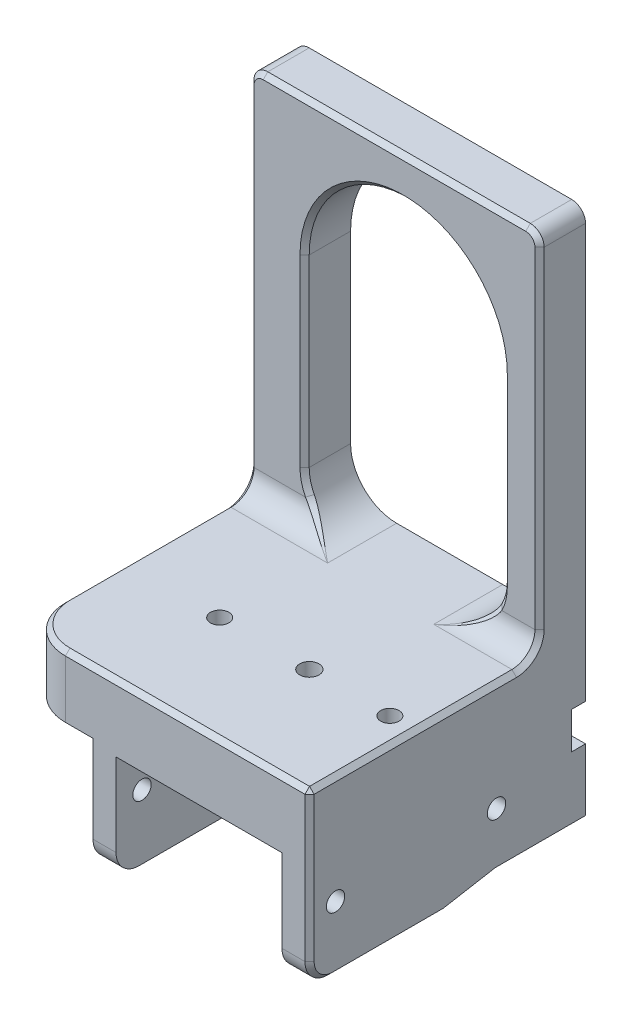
SolidWorks part; units mm, degrees
ref_plane "Aufriss" through (0, 0, 0) normal (0, 0, 1) x (1, 0, 0)
ref_plane "Grundriss" through (0, 0, 0) normal (0, 1, 0) x (1, 0, 0)
ref_plane "Seitenriss" through (0, 0, 0) normal (1, 0, 0) x (0, 0, -1)
sketch "Skizze1" plane through (0, 0, 0) normal (0, 1, 0) x (1, 0, 0)
  line L1 (-15, -30) -> (15, -30)
  line L2 (-15, -30) -> (-15, 30)
  line L3 (-15, 30) -> (15, 30)
  line L4 (15, -30) -> (15, 30)
  line L5 (-15, -30) -> (15, 30) construction
  line L6 (-15, 30) -> (15, -30) construction
  point P0 (0, 0)
  dimension "D1" = 30
  dimension "D2" = 60
extrude "Aufsatz-Linear austragen1" add sketch "Skizze1" along normal mid plane 14.5
hole_wizard "Ø4.0 (4) Durchmesser Bohrung1" positions "Skizze8" profile "Skizze9" hole size "Ø4.0" standard "DIN"
sketch "Skizze8" plane through (0, 7.25, 0) normal (0, 1, 0) x (1, 0, 0)
  line L3 (-15, -30) -> (15, -30) construction
  line L4 (15, -30) -> (15, 30) construction
  point P0 (0.55, -7)
  dimension "D1" = 23
  dimension "D2" = 14.45
sketch "Skizze9" plane through (0.55, 7.25, 7) normal (1, 0, 0) x (0, 0, 1)
  line L0 (0, 0) -> (0, 14.5)
  line L1 (0, 14.5) -> (2.1, 14.5)
  line L2 (2.1, 14.5) -> (2.1, 0)
  line L5 (2.1, 0) -> (0, 0)
  line L11 (0, -6.35) -> (0, 107.95) construction
  dimension "Bohrerdurchmesser" = 4.2
  dimension "Bohrungstiefe" = 14.5
sketch "Skizze10" plane through (0, -7.25, 0) normal (0, -1, 0) x (1, 0, 0)
  line L0 (-15, 6) -> (-7.3873, 6)
  line L1 (-15, -30) -> (-15, 30) construction
  line L2 (15, 30) -> (15, -30) construction
  line L3 (15, 6) -> (15, -30)
  line L4 (15, -30) -> (-15, -30)
  line L5 (-15, -30) -> (-15, 6)
  line L6 (8.4873, 6) -> (15, 6)
  line L7 (15, -30) -> (-15, -30) construction
  arc A0 (-7.3873, 6) -> (8.4873, 6) centre (0.55, 7) ccw
  dimension "D1" = 16
  dimension "D2" = 1
extrude "Aufsatz-Linear austragen2" add sketch "Skizze10" along normal blind 19
sketch "Skizze14" plane through (0, 0, 6) normal (0, 0, 1) x (1, 0, 0)
  line L0 (-15, 7.25) -> (15, 7.25) construction
  line L1 (-15, -26.25) -> (-17.3873, -26.25)
  line L2 (-15, -26.25) -> (-15, 7.25)
  line L3 (-15, 7.25) -> (-17.3873, 7.25)
  line L4 (-17.3873, -26.25) -> (-17.3873, 7.25)
  line L5 (15, -26.25) -> (18.4873, -26.25)
  line L6 (15, -26.25) -> (15, 7.25)
  line L7 (15, 7.25) -> (18.4873, 7.25)
  line L8 (18.4873, -26.25) -> (18.4873, 7.25)
  line L9 (-7.3873, -26.25) -> (-7.3873, -7.25) construction
  line L10 (8.4873, -26.25) -> (8.4873, -7.25) construction
  dimension "D1" = 10
  dimension "D2" = 10
extrude "Aufsatz-Linear austragen3" add sketch "Skizze14" against normal up to surface (36 mm away)
hole_wizard "Ø4.0 (4) Durchmesser Bohrung2" positions "Skizze15" profile "Skizze16" hole size "Ø4.0" standard "DIN"
sketch "Skizze15" plane through (0, 0, 6) normal (0, 0, 1) x (1, 0, 0)
  line L0 (-7.3873, -16.75) -> (-12.3873, -16.75) construction
  line L1 (-7.3873, -26.25) -> (-7.3873, -7.25) construction
  line L3 (-17.3873, 7.25) -> (-17.3873, -26.25) construction
  line L4 (18.4873, -26.25) -> (18.4873, 7.25) construction
  point P0 (-12.3873, -16.75)
  point P2 (13.4873, -16.75)
  dimension "D1" = 5
  dimension "D2" = 5
sketch "Skizze16" plane through (-12.3873, -16.75, 6) normal (1, 0, 0) x (0, -1, 0)
  line L0 (0, 0) -> (0, 6)
  line L1 (0, 6) -> (2, 6)
  line L2 (2, 6) -> (2, 0)
  line L5 (2, 0) -> (0, 0)
  line L10 (0, 6) -> (-2, 6) construction
  line L11 (0, -6.35) -> (0, 107.95) construction
  dimension "Bohrerdurchmesser" = 4
  dimension "Bohrungstiefe" = 6
  dimension "Spitzenwinkel" = 180
sketch "Skizze17" plane through (0, -26.25, 0) normal (0, -1, 0) x (1, 0, 0)
  line L0 (18.4873, -30) -> (18.4873, 6) construction
  line L1 (-17.3873, -30) -> (18.4873, -30)
  line L2 (-17.3873, -30) -> (-17.3873, -10.5)
  line L3 (-17.3873, -10.5) -> (18.4873, -10.5)
  line L4 (18.4873, -30) -> (18.4873, -10.5)
  dimension "D1" = 19.5
extrude "Aufsatz-Linear austragen4" add sketch "Skizze17" along normal blind 2
hole_wizard "Ø4.0 (4) Durchmesser Bohrung3" positions "Skizze18" profile "Skizze19" hole size "Ø4.0" standard "DIN"
sketch "Skizze18" plane through (0, -28.25, 0) normal (0, -1, 0) x (-1, 0, 0)
  line L2 (17.3873, 30) -> (-18.4873, 30) construction
  circle A1 centre (-0.55, -7) radius 2.1 construction
  point P0 (-9.55, 18)
  point P2 (8.45, 18)
  dimension "D1" = 9
  dimension "D2" = 9
  dimension "D3" = 12
sketch "Skizze19" plane through (9.55, -28.25, -18) normal (1, 0, 0) x (0, 0, -1)
  line L0 (0, 0) -> (0, 6)
  line L1 (0, 6) -> (2, 6)
  line L2 (2, 6) -> (2, 0)
  line L5 (2, 0) -> (0, 0)
  line L10 (0, 6) -> (-2, 6) construction
  line L11 (0, -6.35) -> (0, 107.95) construction
  dimension "Bohrerdurchmesser" = 4
  dimension "Bohrungstiefe" = 6
  dimension "Spitzenwinkel" = 180
sketch "Skizze20" plane through (0, 0, 30) normal (0, 0, 1) x (1, 0, 0)
  line L1 (-17.3873, 7.25) -> (-15, 7.25)
  line L2 (-17.3873, 7.25) -> (-17.3873, -7.25)
  line L3 (-17.3873, -7.25) -> (-15, -7.25)
  line L4 (-15, 7.25) -> (-15, -7.25)
  line L5 (15, -7.25) -> (18.4873, -7.25)
  line L6 (15, -7.25) -> (15, 7.25)
  line L7 (15, 7.25) -> (18.4873, 7.25)
  line L8 (18.4873, -7.25) -> (18.4873, 7.25)
extrude "Aufsatz-Linear austragen5" add sketch "Skizze20" against normal up to surface (24 mm away)
sketch "Skizze27" plane through (18.4873, 0, 0) normal (1, 0, 0) x (0, 0, -1)
  line L8 (30, -28.25) -> (30, 7.25)
  line L9 (30, 7.25) -> (-30, 7.25)
  line L10 (-30, 7.25) -> (-30, -7.25)
  line L11 (-30, -7.25) -> (-6, -7.25)
  line L12 (-6, -7.25) -> (-6, -26.25)
  line L13 (-6, -26.25) -> (10.5, -26.25)
  line L14 (10.5, -26.25) -> (10.5, -28.25)
  line L15 (10.5, -28.25) -> (30, -28.25)
  line L16 (30, -28.25) -> (30, 7.25)
  line L17 (30, 7.25) -> (-30, 7.25)
  line L18 (-30, 7.25) -> (-30, -7.25)
  line L19 (-30, -7.25) -> (-6, -7.25)
  line L20 (-6, -7.25) -> (-6, -26.25)
  line L21 (-6, -26.25) -> (10.5, -26.25)
  line L22 (10.5, -26.25) -> (10.5, -28.25)
  line L23 (10.5, -28.25) -> (30, -28.25)
  dimension "D1" = 0
extrude "Aufsatz-Linear austragen7" add sketch "Skizze27" along normal blind 5.1
sketch "Skizze26" plane through (-17.3873, 0, 0) normal (-1, 0, 0) x (0, 0, 1)
  line L8 (-30, 7.25) -> (-30, -28.25)
  line L9 (-30, -28.25) -> (-10.5, -28.25)
  line L10 (-10.5, -28.25) -> (-10.5, -26.25)
  line L11 (-10.5, -26.25) -> (6, -26.25)
  line L12 (6, -26.25) -> (6, -7.25)
  line L13 (6, -7.25) -> (30, -7.25)
  line L14 (30, -7.25) -> (30, 7.25)
  line L15 (30, 7.25) -> (-30, 7.25)
  line L16 (-30, 7.25) -> (-30, -28.25)
  line L17 (-30, -28.25) -> (-10.5, -28.25)
  line L18 (-10.5, -28.25) -> (-10.5, -26.25)
  line L19 (-10.5, -26.25) -> (6, -26.25)
  line L20 (6, -26.25) -> (6, -7.25)
  line L21 (6, -7.25) -> (30, -7.25)
  line L22 (30, -7.25) -> (30, 7.25)
  line L23 (30, 7.25) -> (-30, 7.25)
  dimension "D1" = 0
extrude "Aufsatz-Linear austragen6" add sketch "Skizze26" along normal blind 7.1
hole_wizard "Ø4.0 (4) Durchmesser Bohrung4" positions "Skizze4" profile "Skizze5" hole size "Ø4.0" standard "DIN"
sketch "Skizze4" plane through (0, 7.25, 0) normal (0, 1, 0) x (1, 0, 0)
  line L2 (-18.95, -7) -> (0.55, -7) construction
  line L3 (0.55, -7) -> (18.05, -7) construction
  point P0 (-18.95, -7)
  point P2 (18.05, -7)
  dimension "D1" = 19.5
  dimension "D2" = 37
sketch "Skizze5" plane through (-18.95, 7.25, 7) normal (1, 0, 0) x (0, 0, 1)
  line L0 (0, 0) -> (0, 7)
  line L1 (0, 7) -> (2, 7)
  line L2 (2, 7) -> (2, 0)
  line L5 (2, 0) -> (0, 0)
  line L10 (0, 7) -> (-2, 7) construction
  line L11 (0, -6.35) -> (0, 107.95) construction
  dimension "Bohrerdurchmesser" = 4
  dimension "Bohrungstiefe" = 7
  dimension "Spitzenwinkel" = 180
hole_wizard "Ø4.0 (4) Durchmesser Bohrung5" positions "Skizze28" profile "Skizze29" hole size "Ø4.0" standard "DIN"
sketch "Skizze28" plane through (0, 0, -30) normal (0, 0, -1) x (-1, 0, 0)
  line L1 (24.4873, -28.25) -> (-23.5873, -28.25) construction
  line L3 (-23.5873, 7.25) -> (24.4873, 7.25) construction
  line L4 (-23.5873, -28.25) -> (-23.5873, 7.25) construction
  point P0 (-11.5873, 2.25)
  point P2 (3.4127, 2.25)
  point P4 (18.4127, 2.25)
  point P6 (18.4127, -21.75)
  point P8 (3.4127, -21.75)
  point P10 (-11.5873, -21.75)
  dimension "D1" = 15
  dimension "D2" = 15
  dimension "D3" = 6.5
  dimension "D4" = 5
  dimension "D5" = 12
sketch "Skizze29" plane through (11.5873, 2.25, -30) normal (1, 0, 0) x (0, 1, 0)
  line L0 (0, 0) -> (0, 7)
  line L1 (0, 7) -> (2, 7)
  line L2 (2, 7) -> (2, 0)
  line L5 (2, 0) -> (0, 0)
  line L10 (0, 7) -> (-2, 7) construction
  line L11 (0, -6.35) -> (0, 107.95) construction
  dimension "Bohrerdurchmesser" = 4
  dimension "Bohrungstiefe" = 7
  dimension "Spitzenwinkel" = 180
sketch "Skizze33" plane through (0, -7.25, 0) normal (0, -1, 0) x (1, 0, 0)
  line L0 (-7.3873, 6) -> (-24.4873, 6) construction
  line L1 (-24.4873, 30) -> (-18.4873, 30)
  line L2 (-24.4873, 30) -> (-24.4873, 6)
  line L3 (-24.4873, 6) -> (-18.4873, 6)
  line L4 (-18.4873, 30) -> (-18.4873, 6)
  line L6 (23.5873, 30) -> (17.5873, 30)
  line L7 (23.5873, 30) -> (23.5873, 6)
  line L8 (23.5873, 6) -> (17.5873, 6)
  line L9 (17.5873, 30) -> (17.5873, 6)
  dimension "D1" = 6
  dimension "D2" = 6
extrude "Aufsatz-Linear austragen10" add sketch "Skizze33" along normal up to surface (19 mm away)
hole_wizard "Ø4.0 (4) Durchmesser Bohrung6" positions "Skizze21" profile "Skizze22" hole size "Ø4.0" standard "DIN"
sketch "Skizze21" plane through (23.5873, 0, 0) normal (1, 0, 0) x (0, 0, -1)
  line L2 (30, 7.25) -> (-30, 7.25) construction
  line L3 (-30, 7.25) -> (-30, -26.25) construction
  point P0 (-24.35, -16.25)
  point P2 (10.65, -16.25)
  dimension "D1" = 23.5
  dimension "D2" = 5.65
  dimension "D3" = 35
sketch "Skizze22" plane through (23.5873, -16.25, 24.35) normal (0, 1, 0) x (0, 0, -1)
  line L0 (0, 0) -> (0, 6)
  line L1 (0, 6) -> (2, 6)
  line L2 (2, 6) -> (2, 0)
  line L5 (2, 0) -> (0, 0)
  line L10 (0, 6) -> (-2, 6) construction
  line L11 (0, -6.35) -> (0, 107.95) construction
  dimension "Bohrerdurchmesser" = 4
  dimension "Bohrungstiefe" = 6
  dimension "Spitzenwinkel" = 180
hole_wizard "Ø4.0 (4) Durchmesser Bohrung7" positions "Skizze23" profile "Skizze24" hole size "Ø4.0" standard "DIN"
sketch "Skizze23" plane through (-24.4873, 0, 0) normal (-1, 0, 0) x (0, 0, 1)
  point P0 (24.35, -16.25)
  point P3 (-10.65, -16.25)
sketch "Skizze24" plane through (-24.4873, -16.25, 24.35) normal (0, 1, 0) x (0, 0, 1)
  line L0 (0, 0) -> (0, 6)
  line L1 (0, 6) -> (2, 6)
  line L2 (2, 6) -> (2, 0)
  line L5 (2, 0) -> (0, 0)
  line L10 (0, 6) -> (-2, 6) construction
  line L11 (0, -6.35) -> (0, 107.95) construction
  dimension "Bohrerdurchmesser" = 4
  dimension "Bohrungstiefe" = 6
  dimension "Spitzenwinkel" = 180
sketch "Skizze34" plane through (-24.4873, 0, 0) normal (-1, 0, 0) x (0, 0, 1)
  line L0 (30, -26.25) -> (30, 7.25) construction
  line L1 (-30, 7.25) -> (30, 7.25)
  line L2 (-30, 7.25) -> (-30, -7.25)
  line L3 (-30, -7.25) -> (30, -7.25)
  line L4 (30, 7.25) -> (30, -7.25)
extrude "Aufsatz-Linear austragen11" add sketch "Skizze34" along normal blind 15
sketch "Skizze43" plane through (0, 0, -30) normal (0, 0, -1) x (-1, 0, 0)
  line L0 (-23.5873, 7.25) -> (-23.5873, 87.25)
  line L1 (-23.5873, 87.25) -> (39.4873, 87.25)
  line L2 (39.4873, 87.25) -> (39.4873, 7.25)
  line L3 (39.4873, 7.25) -> (27.4873, 7.25)
  line L4 (-23.5873, 7.25) -> (39.4873, 7.25) construction
  line L5 (27.4873, 7.25) -> (27.4873, 57.25)
  line L6 (-15.5873, 57.25) -> (-15.5873, 7.25)
  line L7 (-15.5873, 7.25) -> (-23.5873, 7.25)
  arc A0 (27.4873, 57.25) -> (-15.5873, 57.25) centre (5.95, 57.25) ccw
  dimension "D1" = 8
  dimension "D2" = 12
  dimension "D3" = 50
  dimension "D4" = 80
extrude "Aufsatz-Linear austragen15" add sketch "Skizze43" against normal blind 10
fillet "Verrundung1" radius 10 2 edges at (-27.4873, 7.25, -25) (15.5873, 7.25, -25)
hole_wizard "Ø4.0 (4) Durchmesser Bohrung8" positions "Skizze44" profile "Skizze45" hole size "Ø4.0" standard "DIN"
sketch "Skizze44" plane through (0, 0, -30) normal (0, 0, -1) x (-1, 0, 0)
  line L0 (-23.5873, -28.25) -> (-23.5873, 87.25) construction
  line L1 (39.4873, 87.25) -> (39.4873, -7.25) construction
  line L2 (39.4873, 87.25) -> (-23.5873, 87.25) construction
  point P0 (-19.5873, 83.25)
  point P2 (35.4873, 83.25)
  point P4 (35.4873, 13.25)
  point P6 (-19.5873, 13.25)
  point P15 (-19.5873, 53.25)
  point P17 (35.4873, 53.25)
  dimension "D1" = 4
  dimension "D2" = 4
  dimension "D3" = 4
  dimension "D4" = 70
  dimension "D5" = 30
sketch "Skizze45" plane through (19.5873, 83.25, -30) normal (1, 0, 0) x (0, 1, 0)
  line L0 (0, 0) -> (0, 7)
  line L1 (0, 7) -> (2, 7)
  line L2 (2, 7) -> (2, 0)
  line L5 (2, 0) -> (0, 0)
  line L10 (0, 7) -> (-2, 7) construction
  line L11 (0, -6.35) -> (0, 107.95) construction
  dimension "Bohrerdurchmesser" = 4
  dimension "Bohrungstiefe" = 7
  dimension "Spitzenwinkel" = 180
sketch "Skizze47" plane through (0, 0, -30) normal (0, 0, -1) x (-1, 0, 0)
  line L0 (-23.5873, -28.25) -> (-23.5873, 87.25) construction
  line L1 (-23.5873, -5.75) -> (24.4873, -5.75)
  line L2 (-23.5873, -5.75) -> (-23.5873, -13.75)
  line L3 (-23.5873, -13.75) -> (24.4873, -13.75)
  line L4 (24.4873, -5.75) -> (24.4873, -13.75)
  line L7 (24.4873, -7.25) -> (24.4873, -28.25) construction
  circle A0 centre (-11.5873, -21.75) radius 2 construction
  circle A1 centre (-11.5873, 2.25) radius 2 construction
  dimension "D1" = 8
  dimension "D2" = 8
extrude "Schnitt-Linear austragen2" cut sketch "Skizze47" against normal blind 3
fillet "Verrundung2" radius 3 2 edges at (23.5873, 87.25, -25) (-39.4873, 87.25, -25)
fillet "Verrundung3" radius 5 2 edges at (14.5873, 7.25, -20) (-28.4873, 7.25, -20)
fillet "Verrundung4" radius 10 1 edges at (-39.4873, 0, 30)
sketch "Skizze48" plane through (0, -26.25, 0) normal (0, -1, 0) x (1, 0, 0)
  line L0 (23.5873, -10.5) -> (-24.4873, -10.5) construction
  line L1 (-24.4873, 30) -> (-18.4873, 30)
  line L2 (-24.4873, 30) -> (-24.4873, -10.5)
  line L3 (-24.4873, -10.5) -> (-18.4873, -10.5)
  line L4 (-18.4873, 30) -> (-18.4873, -10.5)
  line L6 (23.5873, 30) -> (17.5873, 30)
  line L7 (23.5873, 30) -> (23.5873, -10.5)
  line L8 (23.5873, -10.5) -> (17.5873, -10.5)
  line L9 (17.5873, 30) -> (17.5873, -10.5)
extrude "Aufsatz-Linear austragen16" add sketch "Skizze48" along normal blind 4
chamfer "Fase2" distance 2 angle 80 2 edges at (20.5873, -30.25, -10.5) (-21.4873, -30.25, -10.5)
fillet "Verrundung5" radius 5 2 edges at (20.5873, -30.25, 30) (-21.4873, -30.25, 30)
chamfer "Fase3" distance 1 angle 45 31 edges at (10.5177, 8.55, -18.363) (-22.4177, 8.55, -18.363) (15.2465, 14.6618, -20) (-27.1465, 14.6618, -20) (15.5873, 37.25, -20) (-27.4873, 37.25, -20) (-5.95, 78.7873, -20) (-2.95, 7.25, 30) (-26.9873, -7.25, 30) (-36.5583, -7.25, 27.0711) (-36.5583, 7.25, 27.0711) (-39.4873, 7.25, 2.5) (23.5873, 7.25, 7.5) (-39.4873, 8.7145, -18.5355) (23.5873, 8.7145, -18.5355) (-39.4873, 48.25, -20) (23.5873, 48.25, -20) (-38.6086, 86.3713, -20) (22.7086, 86.3713, -20) (-7.95, 87.25, -20) (-39.4873, -7.25, -5) (23.5873, -29.25, -4.8287) (23.5873, -28.25, -20.25) (-24.4873, -28.25, -20.25) (-24.4873, -29.25, -4.8287) (23.5873, -30.25, 12.9213) (23.5873, -28.7855, 28.5355) (23.5873, -9, 30) (-24.4873, -30.25, 12.9213) (-24.4873, -28.7855, 28.5355) (-24.4873, -16.25, 30)
